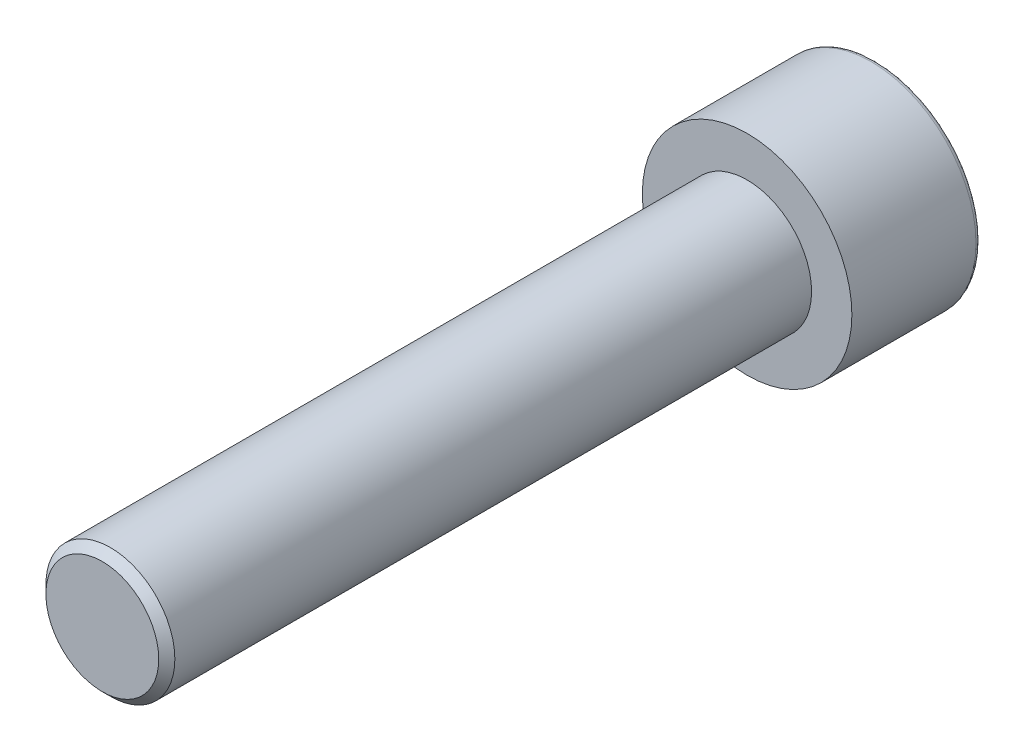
SolidWorks part; units mm, degrees
ref_plane "Plane1" through (0, 0, 0) normal (0, 0, 1) x (1, 0, 0)
ref_plane "Plane2" through (0, 0, 0) normal (0, 1, 0) x (1, 0, 0)
ref_plane "Plane3" through (0, 0, 0) normal (1, 0, 0) x (0, 0, -1)
sketch "Esquisse1" plane through (0, 0, 0) normal (0, 0, 1) x (1, 0, 0)
  circle A0 centre (0, 0) radius 6.5
  dimension "D1" = 13
extrude "Base-Extrusion" add sketch "Esquisse1" along normal blind 8
sketch "Esquisse2" plane through (0, 0, 8) normal (0, 0, 1) x (1, 0, 0)
  circle A0 centre (0, 0) radius 4
  dimension "D1" = 8
extrude "Boss.-Extru.1" add sketch "Esquisse2" along normal blind 40
chamfer "Chanfrein1" distance 0.5 angle 45
sketch "Esquisse3" plane through (0, 0, 0) normal (0, 0, -1) x (-1, 0, 0)
  line L0 (0, 0) -> (0, -10) construction
  line L1 (0, 0) -> (-10, 0) construction
  line L2 (1.7321, 3) -> (-1.7321, 3)
  line L3 (3.4641, 0) -> (1.7321, -3)
  line L4 (1.7321, 3) -> (3.4641, 0)
  line L5 (1.7321, -3) -> (-1.7321, -3)
  line L6 (-3.4641, 0) -> (-1.7321, -3)
  line L7 (-1.7321, 3) -> (-3.4641, 0)
  dimension "D1" = 3
  dimension "D2" = 120
  dimension "D4" = 3
extrude "Enlèv. mat.-Extru.1" cut sketch "Esquisse3" against normal blind 6
fillet "Congé1" radius 0.3
